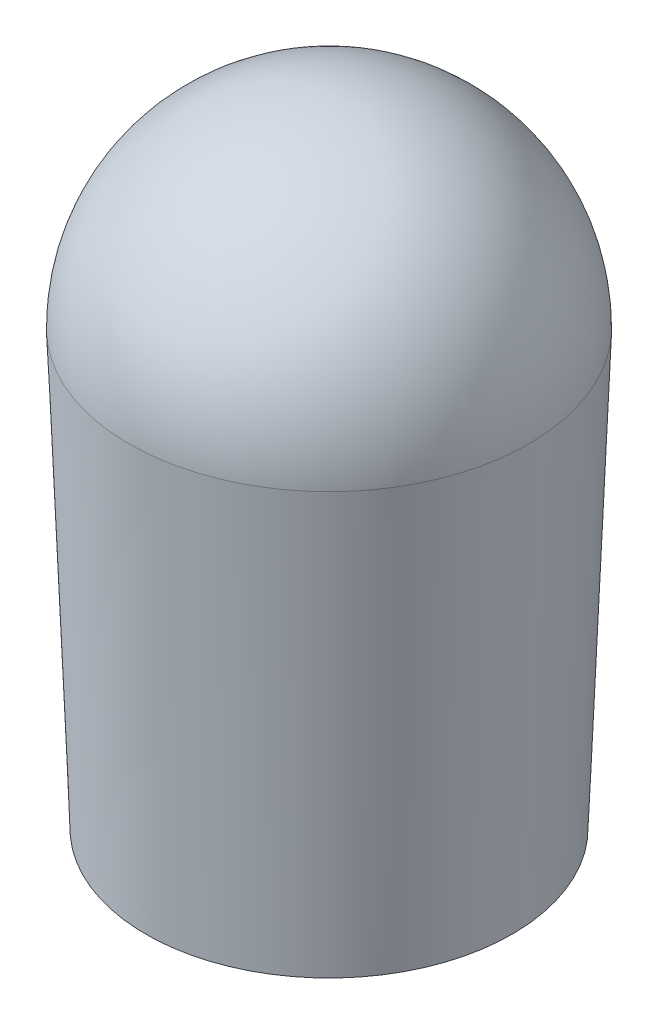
SolidWorks part; units mm, degrees
ref_plane "Face" through (0, 0, 0) normal (0, 0, 1) x (1, 0, 0)
ref_plane "Dessus" through (0, 0, 0) normal (0, 1, 0) x (1, 0, 0)
ref_plane "Droite" through (0, 0, 0) normal (1, 0, 0) x (0, 0, -1)
sketch "Esquisse1" plane through (0, 0, 0) normal (0, 0, 1) x (1, 0, 0)
  line L0 (0, -23.1817) -> (0, 31.5002) construction
  line L1 (-5.5, 0) -> (-4, 0)
  line L2 (-4, 0) -> (-4, 15)
  line L3 (-4, 15) -> (0, 15)
  line L4 (0, 15) -> (0, 19)
  line L6 (-6, 13) -> (-5.5, 0)
  arc A1 (0, 19) -> (-6, 13) centre (0, 13) ccw
  dimension "D5" = 6
  dimension "D1" = 4
  dimension "D2" = 1.5
  dimension "D3" = 15
  dimension "D4" = 4
revolve "Révolution1" add sketch "Esquisse1" angle 360 about L0
